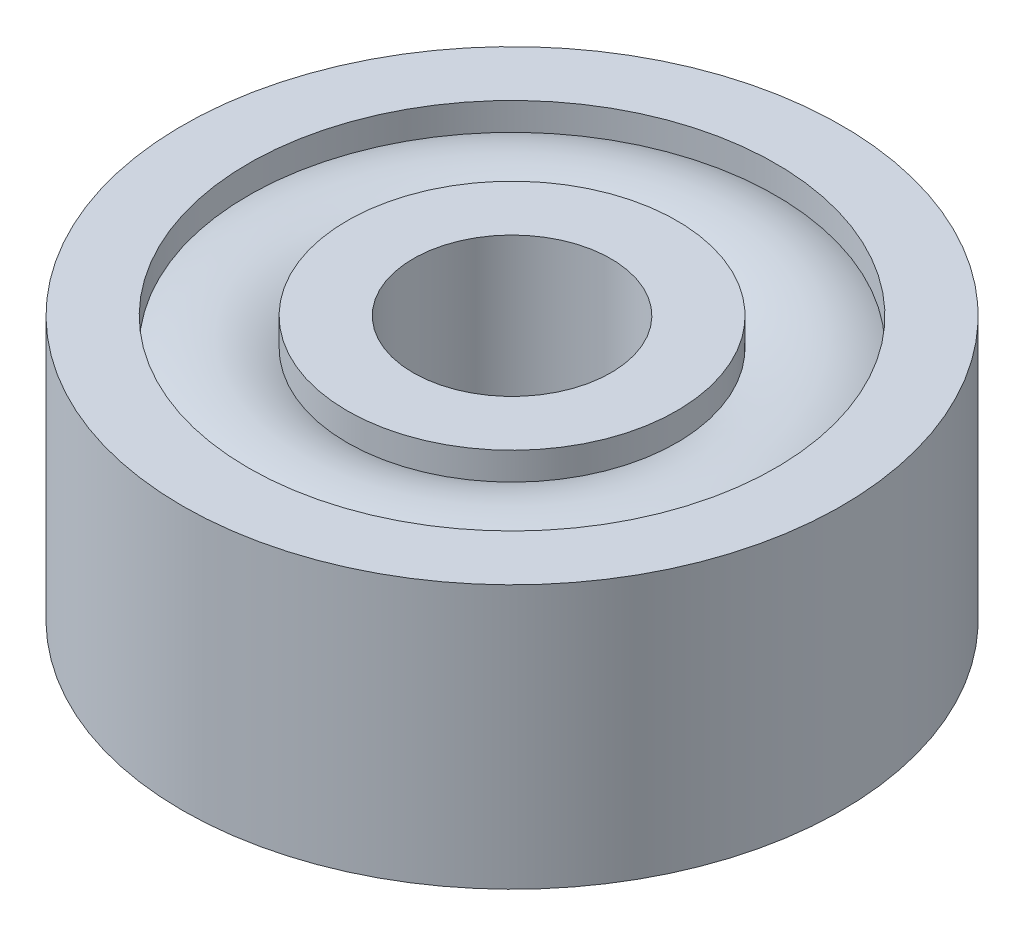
SolidWorks part; units mm, degrees
ref_plane "Front Plane" through (0, 0, 0) normal (0, 0, 1) x (1, 0, 0)
ref_plane "Top Plane" through (0, 0, 0) normal (0, 1, 0) x (1, 0, 0)
ref_plane "Right Plane" through (0, 0, 0) normal (1, 0, 0) x (0, 0, -1)
sketch "Sketch1" plane through (0, 0, 0) normal (0, 0, 1) x (1, 0, 0)
  line L0 (1.5, 2) -> (1.5, -2)
  line L1 (0, 2) -> (1.5, 2) construction
  line L2 (0, 2) -> (0, -2) construction
  line L3 (0, -2) -> (1.5, -2) construction
  line L4 (5, 2) -> (5, -2)
  line L5 (1.5, 2) -> (2.5, 2)
  line L6 (1.5, -2) -> (2.5, -2)
  line L7 (2.5, 2) -> (2.5, 1.5811)
  line L8 (4, 2) -> (4, 1.5811)
  line L9 (1.5, 0) -> (5, 0) construction
  line L10 (4, 2) -> (5, 2)
  line L11 (4, -2) -> (5, -2)
  line L12 (2.5, -1.5811) -> (2.5, -2)
  line L13 (4, -1.5811) -> (4, -2)
  arc A0 (4, 1.5811) -> (2.5, 1.5811) centre (3.25, 0) ccw
  arc A1 (2.5, -1.5811) -> (4, -1.5811) centre (3.25, 0) ccw
  dimension "D1" = 4
  dimension "D2" = 5
  dimension "D3" = 1.5
revolve "Revolve1" add sketch "Sketch1" angle 360 about L2
